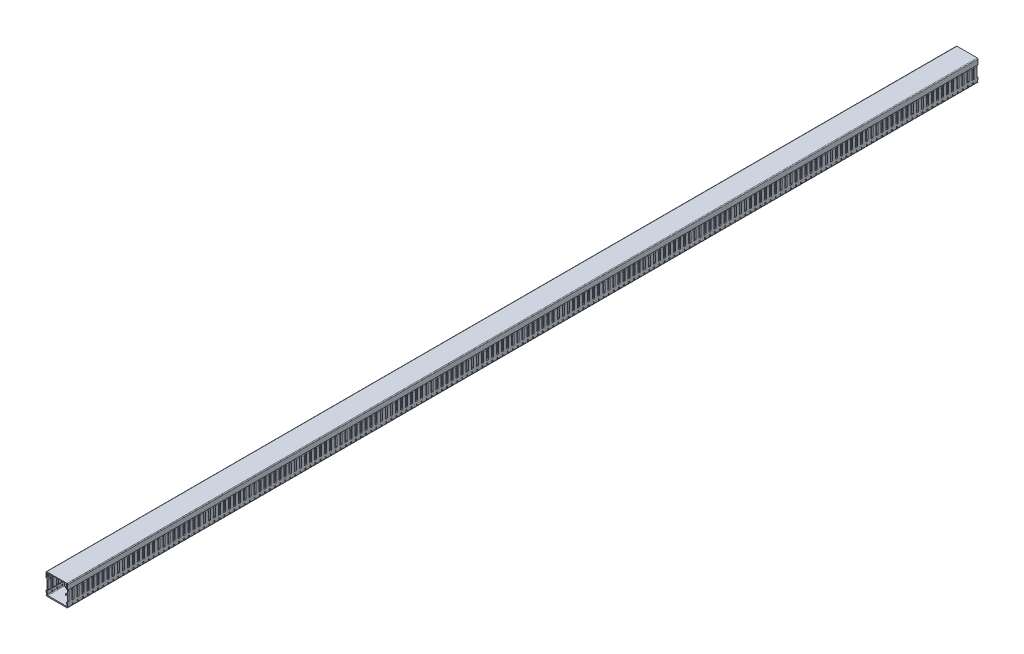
SolidWorks part; units mm, degrees
ref_plane "Front Plane" through (0, 0, 0) normal (0, 0, 1) x (1, 0, 0)
ref_plane "Top Plane" through (0, 0, 0) normal (0, 1, 0) x (1, 0, 0)
ref_plane "Right Plane" through (0, 0, 0) normal (1, 0, 0) x (0, 0, -1)
imported_body "Unex-4040.STEP"
sketch "Sketch1" plane through (0, 1.2, 0) normal (0, 1, 0) x (1, 0, 0)
  line L0 (-20, 2000) -> (20, 2000) construction
  line L1 (-26.2759, 2041.9765) -> (42.6898, 2041.9765)
  line L2 (-26.2759, 2041.9765) -> (-26.2759, 1800)
  line L3 (-26.2759, 1800) -> (42.6898, 1800)
  line L4 (42.6898, 2041.9765) -> (42.6898, 1800)
  dimension "D1" = 200
extrude "Cut-Extrude1" cut sketch "Sketch1" against normal blind 175
